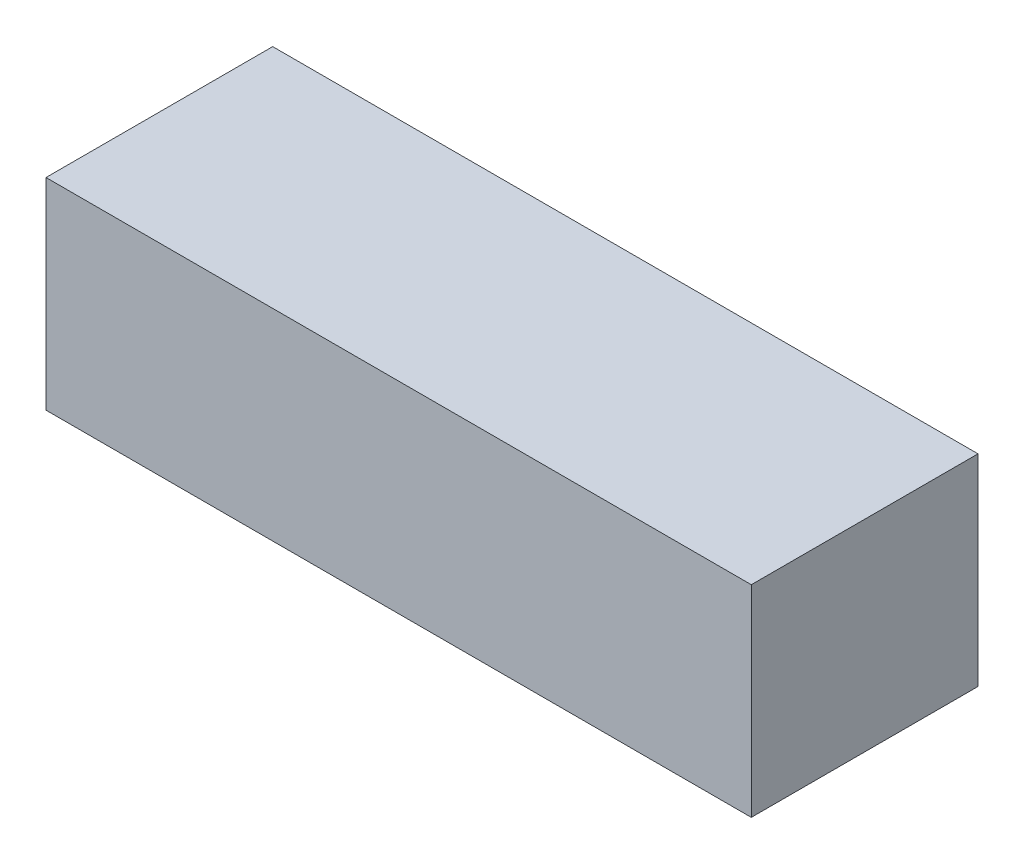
SolidWorks part; units mm, degrees
ref_plane "Front Plane" through (0, 0, 0) normal (0, 0, 1) x (1, 0, 0)
ref_plane "Top Plane" through (0, 0, 0) normal (0, 1, 0) x (1, 0, 0)
ref_plane "Right Plane" through (0, 0, 0) normal (1, 0, 0) x (0, 0, -1)
sketch "Sketch1" plane through (0, 0, 0) normal (0, 1, 0) x (1, 0, 0)
  line L1 (-7, 2.25) -> (7, 2.25)
  line L2 (-7, 2.25) -> (-7, -2.25)
  line L3 (-7, -2.25) -> (7, -2.25)
  line L4 (7, 2.25) -> (7, -2.25)
  line L5 (-7, 2.25) -> (7, -2.25) construction
  line L6 (-7, -2.25) -> (7, 2.25) construction
  point P0 (0, 0)
  dimension "D1" = 4.5
  dimension "D2" = 14
extrude "Extrude1" add sketch "Sketch1" along normal blind 4
